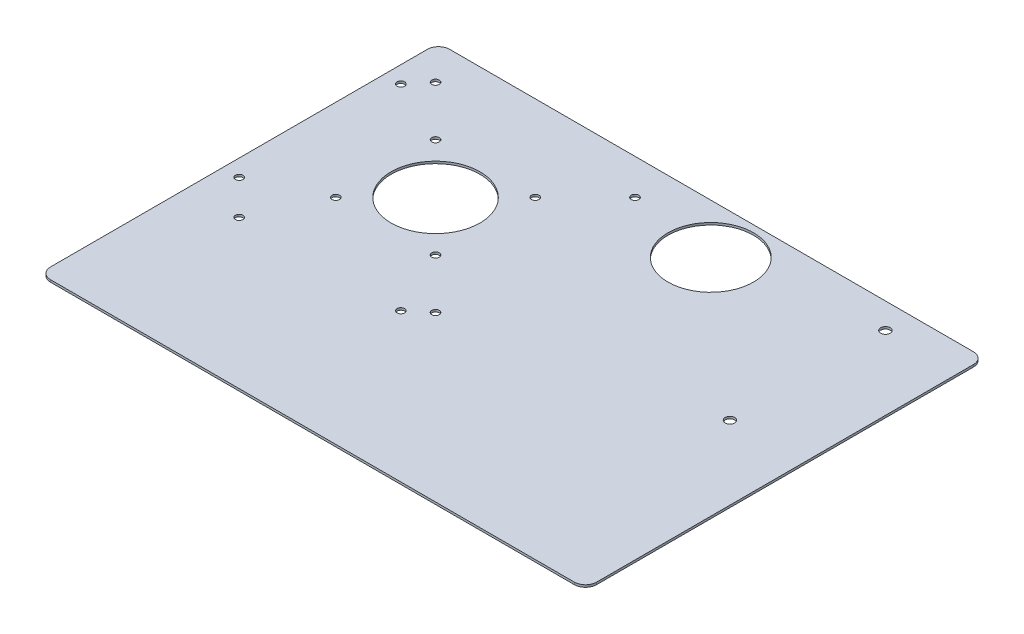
SolidWorks part; units mm, degrees
ref_plane "Plan de face" through (0, 0, 0) normal (0, 0, 1) x (1, 0, 0)
ref_plane "Plan de dessus" through (0, 0, 0) normal (0, 1, 0) x (1, 0, 0)
ref_plane "Plan de droite" through (0, 0, 0) normal (1, 0, 0) x (0, 0, -1)
sketch "Esquisse1" plane through (0, 0, 0) normal (0, 1, 0) x (1, 0, 0)
  line L0 (-119.1, 111.8) -> (-119.1, -227.5)
  line L1 (-109.1, -237.5) -> (362.5, -237.5)
  line L2 (372.5, -227.5) -> (372.5, 111.8)
  line L3 (362.5, 121.8) -> (-109.1, 121.8)
  circle A0 centre (0, 0) radius 40
  circle A1 centre (-104, 72.8) radius 3.4
  circle A2 centre (-89.8, 89.8) radius 3.4
  circle A3 centre (-44.9, 44.9) radius 3.4
  circle A4 centre (44.9, 44.9) radius 3.4
  circle A5 centre (44.9, -44.9) radius 3.4
  circle A6 centre (-44.9, -44.9) radius 3.4
  circle A7 centre (-104, -72.8) radius 3.4
  circle A8 centre (-72.8, -104) radius 3.4
  circle A9 centre (72.8, -104) radius 3.4
  circle A10 centre (89.8, -89.8) radius 3.4
  circle A11 centre (89.8, 89.8) radius 3.4
  arc A12 (-109.1, 121.8) -> (-119.1, 111.8) centre (-109.1, 111.8) ccw
  arc A13 (372.5, 111.8) -> (362.5, 121.8) centre (362.5, 111.8) ccw
  arc A14 (362.5, -237.5) -> (372.5, -227.5) centre (362.5, -227.5) ccw
  arc A15 (-119.1, -227.5) -> (-109.1, -237.5) centre (-109.1, -227.5) ccw
  circle A16 centre (306.3, 98.8) radius 4.3
  circle A17 centre (306.3, -41.2) radius 4.3
  circle A18 centre (170.7, 77.1) radius 38.5
  dimension "D1" = 80
  dimension "D2" = 6.8
  dimension "D4" = 119.1
  dimension "D6" = 237.5
  dimension "D13" = 89.8
  dimension "D24" = 23
  dimension "D3" = 121.8
  dimension "D8" = 89.8
  dimension "D9" = 104
  dimension "D21" = 10
  dimension "D22" = 8.6
  dimension "D26" = 77
  dimension "D27" = 44.7
  dimension "D5" = 372.5
  dimension "D7" = 104
  dimension "D10" = 89.8
  dimension "D11" = 72.8
  dimension "D12" = 72.8
  dimension "D14" = 89.8
  dimension "D15" = 72.8
  dimension "D16" = 72.8
  dimension "D17" = 44.9
  dimension "D18" = 44.9
  dimension "D19" = 44.9
  dimension "D20" = 44.9
  dimension "D23" = 140
  dimension "D25" = 66.2
  dimension "D28" = 201.8
extrude "Extrusion1" add sketch "Esquisse1" along normal blind 2
